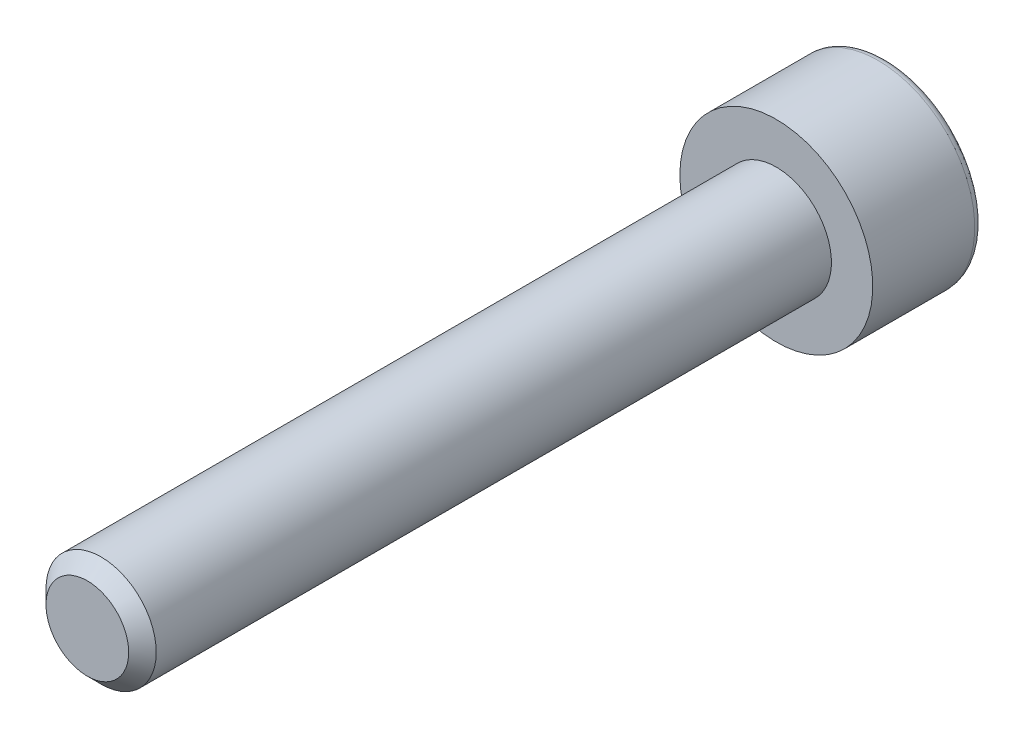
SolidWorks part; units mm, degrees
ref_plane "Face" through (0, 0, 0) normal (0, 0, 1) x (1, 0, 0)
ref_plane "Dessus" through (0, 0, 0) normal (0, 1, 0) x (1, 0, 0)
ref_plane "Droite" through (0, 0, 0) normal (1, 0, 0) x (0, 0, -1)
sketch "Esquisse1" plane through (0, 0, 0) normal (0, 0, 1) x (1, 0, 0)
  circle A0 centre (0, 0) radius 2
  dimension "D1" = 4
extrude "Base-Extrusion" add sketch "Esquisse1" along normal blind 25
chamfer "Chanfrein1" distance 0.5 angle 45 1 edges at (2, 0, 25)
sketch "Esquisse2" plane through (0, 0, 0) normal (0, 0, -1) x (-1, 0, 0)
  circle A0 centre (0, 0) radius 3.5
  dimension "D1" = 7
extrude "Boss.-Extru.1" add sketch "Esquisse2" along normal blind 4
fillet "Congé1" radius 0.3 1 edges at (-3.5, 0, -4)
sketch "Esquisse3" plane through (0, 0, -4) normal (0, 0, -1) x (-1, 0, 0)
  line L1 (0, 1.7321) -> (-1.5, 0.866)
  line L2 (-1.5, 0.866) -> (-1.5, -0.866)
  line L3 (-1.5, -0.866) -> (0, -1.7321)
  line L4 (0, -1.7321) -> (1.5, -0.866)
  line L5 (1.5, -0.866) -> (1.5, 0.866)
  line L6 (1.5, 0.866) -> (0, 1.7321)
  circle A0 centre (0, 0) radius 1.5 construction
  dimension "D1" = 3
extrude "Enlèv. mat.-Extru.1" cut sketch "Esquisse3" against normal blind 4
